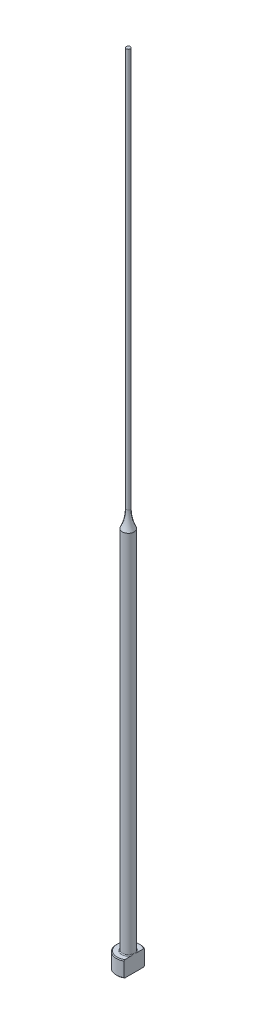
SolidWorks part; units mm, degrees
ref_plane "Front Plane" through (0, 0, 0) normal (0, 0, 1) x (1, 0, 0)
ref_plane "Top Plane" through (0, 0, 0) normal (0, 1, 0) x (1, 0, 0)
ref_plane "Right Plane" through (0, 0, 0) normal (1, 0, 0) x (0, 0, -1)
sketch "Sketch1" plane through (0, 0, 0) normal (0, 0, 1) x (1, 0, 0)
  line L0 (0, 259.9588) -> (0, -15.1925) construction
  line L1 (0, 0) -> (-3, 0)
  line L2 (-3, 0) -> (-3, 4)
  line L3 (-3, 4) -> (-1.5, 4)
  line L4 (-0.5, 100) -> (-0.5, 200)
  line L5 (-0.5, 200) -> (0, 200)
  line L6 (0, 200) -> (0, 0)
  line L7 (-1.5, 4) -> (-1.5, 95.6411)
  arc A0 (-1.5, 95.6411) -> (-0.5, 100) centre (-10.5, 100) ccw
  point P13 (-1.5, 0)
  dimension "D1" = 10
  dimension "L" = 200
  dimension "H" = 6
  dimension "T" = 4
  dimension "D" = 1
  dimension "B" = 3
  dimension "S" = 100
revolve "Revolve1" add sketch "Sketch1" angle 360 about L0
chamfer "Chamfer1" distance 0.2 angle 45 2 edges at (0, 4, 3) (0, 0, 3)
fillet "Fillet1" radius 0.2 1 edges at (0, 4, 1.5)
sketch "Sketch2" plane through (0, 0, 0) normal (0, 1, 0) x (1, 0, 0)
  line L0 (1.5, -2.5981) -> (1.5, 2.5981)
  circle A0 centre (0, 0) radius 3 construction
  arc A1 (1.5, -2.5981) -> (1.5, 2.5981) centre (0, 0) ccw
  circle A2 centre (0, 0) radius 1.5 construction
extrude "Keyed Head" cut sketch "Sketch2" along normal through all
